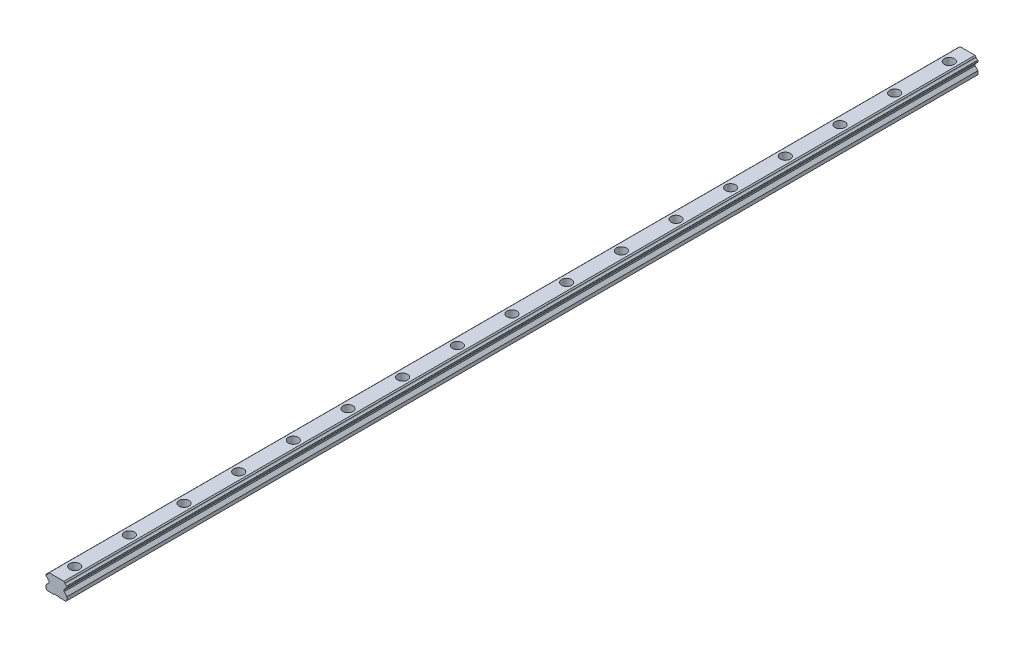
SolidWorks part; units mm, degrees
ref_plane "Front Plane" through (0, 0, 0) normal (0, 0, 1) x (1, 0, 0)
ref_plane "Top Plane" through (0, 0, 0) normal (0, 1, 0) x (1, 0, 0)
ref_plane "Right Plane" through (0, 0, 0) normal (1, 0, 0) x (0, 0, -1)
sketch "Sketch2" plane through (0, 0, 0) normal (0, 0, 1) x (1, 0, 0)
  line L0 (8.1677, -0.6075) -> (8.1677, 1.1925)
  line L1 (8.1677, 1.1925) -> (9.1727, 2.1974)
  line L2 (11.3677, 4.5384) -> (11.3677, 5.8278)
  line L3 (9.1816, 8.0746) -> (8.0637, 9.1925)
  line L4 (8.0637, 9.1925) -> (-8.3283, 9.1925)
  line L5 (-8.3283, 9.1925) -> (-9.4461, 8.0746)
  line L6 (-11.6323, 5.8278) -> (-11.6323, 4.5384)
  line L7 (-9.4372, 2.1974) -> (-8.4323, 1.1925)
  line L8 (-8.4323, 1.1925) -> (-8.4323, -0.6075)
  line L9 (-8.4323, -0.6075) -> (-11.6323, -3.8075)
  line L10 (-11.6323, -3.8075) -> (-11.6323, -7.6075)
  line L11 (-11.6323, -7.6075) -> (-10.4323, -8.8075)
  line L12 (-10.4323, -8.8075) -> (-3.1323, -8.8075)
  line L13 (-3.1323, -8.8075) -> (-2.6323, -8.3075)
  line L14 (-2.6323, -8.3075) -> (2.3677, -8.3075)
  line L15 (2.3677, -8.3075) -> (2.8677, -8.8075)
  line L16 (2.8677, -8.8075) -> (10.1677, -8.8075)
  line L17 (10.1677, -8.8075) -> (11.3677, -7.6075)
  line L18 (11.3677, -7.6075) -> (11.3677, -3.8075)
  line L19 (11.3677, -3.8075) -> (8.1677, -0.6075)
  arc A0 (10.9277, 4.042) -> (9.1727, 2.1974) centre (11.1677, 2.0565) ccw
  arc A1 (10.9277, 4.042) -> (11.3677, 4.5384) centre (10.8677, 4.5384) ccw
  arc A2 (11.3677, 5.8278) -> (10.9278, 6.3242) centre (10.8677, 5.8278) ccw
  arc A3 (9.1816, 8.0746) -> (10.9278, 6.3242) centre (11.1677, 8.3098) ccw
  arc A4 (-11.1923, 6.3242) -> (-9.4461, 8.0746) centre (-11.4323, 8.3098) ccw
  arc A5 (-11.1923, 6.3242) -> (-11.6323, 5.8278) centre (-11.1323, 5.8278) ccw
  arc A6 (-11.6323, 4.5384) -> (-11.1923, 4.042) centre (-11.1323, 4.5384) ccw
  arc A7 (-9.4372, 2.1974) -> (-11.1923, 4.042) centre (-11.4323, 2.0565) ccw
extrude "Boss-Extrude1" add sketch "Sketch2" along normal blind 1000
sketch "Sketch3" plane through (0, 9.1925, 0) normal (0, 1, 0) x (1, 0, 0)
  line L0 (11.3677, -1000) -> (11.3677, 0) construction
  line L2 (8.0637, 0) -> (-8.3283, 0) construction
  point P0 (-0.1323, -20)
  dimension "D1" = 11.5
  dimension "D2" = 20
hole_wizard "CBORE for M16 Hex Head Bolt1" positions "Sketch3" profile "Sketch4" counterbore size "M16" standard "DIN"
sketch "Sketch4" plane through (-0.1323, 9.1925, 20) normal (1, 0, 0) x (0, 0, 1)
  line L0 (0, 0) -> (0, 18)
  line L1 (0, 18) -> (3.5, 18)
  line L3 (3.5, 18) -> (3.5, 9)
  line L4 (3.5, 9) -> (5.5, 9)
  line L5 (5.5, 9) -> (5.5, 0)
  line L7 (5.5, 0) -> (0, 0)
  line L11 (0, -6.35) -> (0, 107.95) construction
  dimension "Thru Hole Dia." = 7
  dimension "Thru Hole Depth" = 18
  dimension "C'Bore Dia." = 11
  dimension "C'Bore Depth" = 9
other "Fill Pattern1" parameters "D5"=0, "D6"=0, "D1"=60, "D2"=60, "D3"=0, "D9"=17, "D7"=17, "D8"=2
